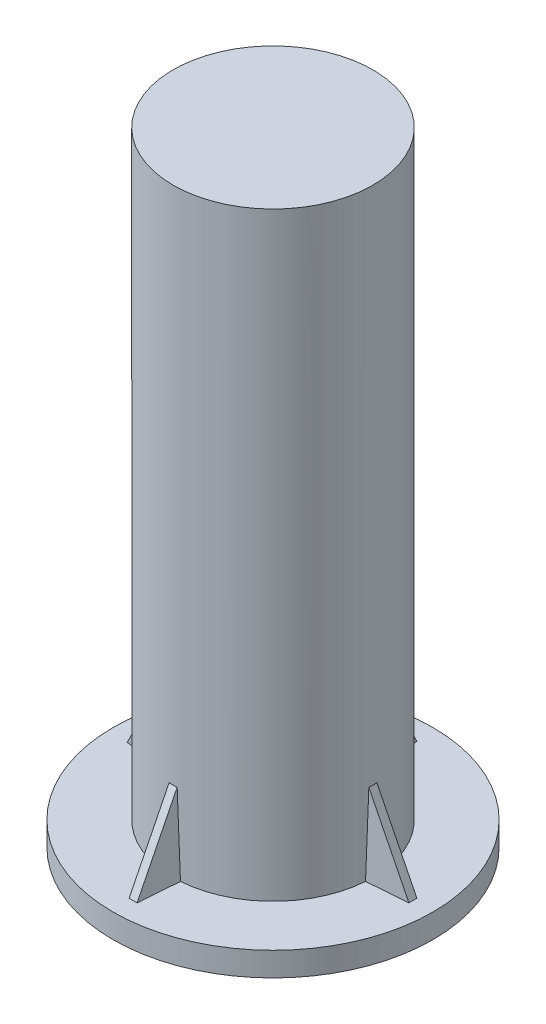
SolidWorks part; units mm, degrees
ref_plane "Alzado" through (0, 0, 0) normal (0, 0, 1) x (1, 0, 0)
ref_plane "Planta" through (0, 0, 0) normal (0, 1, 0) x (1, 0, 0)
ref_plane "Vista lateral" through (0, 0, 0) normal (1, 0, 0) x (0, 0, -1)
sketch "Croquis1" plane through (0, 0, 0) normal (0, 1, 0) x (1, 0, 0)
  circle A0 centre (0, 0) radius 40
  circle A1 centre (0, 0) radius 5
  dimension "D1" = 80
extrude "Saliente-Extruir2" add sketch "Croquis1" along normal blind 6
sketch "Croquis3" plane through (0, 6, 0) normal (0, 1, 0) x (1, 0, 0)
  circle A0 centre (0, 0) radius 25
  dimension "D1" = 50
extrude "Saliente-Extruir3" add sketch "Croquis3" along normal blind 150
ref_plane "Plano1" through (0, 0, 0) normal (0, 0, 1) x (1, 0, 0)
sketch "Croquis9" plane through (0, 0, 0) normal (0, 0, 1) x (1, 0, 0)
  line L0 (-35, 6) -> (-25, 26)
  line L1 (40, 6) -> (-40, 6) construction
  line L2 (-25, 156) -> (-25, 6) construction
  dimension "D3" = 20
  dimension "D4" = 10
rib "Nervio26" sketch "Croquis9" sketch "Croquis9" thickness 3 extrusion direction parallel to sketch draft on yes draft angle 5 parameters "D1"=3, "D3"=5
sketch "Croquis11" plane through (0, 0, 0) normal (0, 0, 1) x (1, 0, 0)
  line L0 (35, 6) -> (25, 26)
  line L1 (40, 6) -> (-40, 6) construction
  line L2 (25, 6) -> (25, 156) construction
  dimension "D1" = 20
  dimension "D2" = 10
rib "Nervio27" sketch "Croquis11" sketch "Croquis11" thickness 2 extrusion direction parallel to sketch draft on yes draft angle 5 parameters "D1"=2, "D3"=5
ref_plane "Plano2" through (0, 0, 0) normal (1, 0, 0) x (0, 0, -1)
sketch "Croquis12" plane through (0, 0, 0) normal (1, 0, 0) x (0, 0, -1)
  line L0 (-35, 6) -> (-25, 26)
  line L1 (40, 6) -> (-40, 6) construction
  line L2 (-25, 156) -> (-25, 6) construction
  dimension "D1" = 20
  dimension "D2" = 10
rib "Nervio28" sketch "Croquis12" sketch "Croquis12" thickness 2 extrusion direction parallel to sketch draft on yes draft angle 5 parameters "D1"=2, "D3"=5
sketch "Croquis13" plane through (0, 0, 0) normal (1, 0, 0) x (0, 0, -1)
  line L0 (35, 6) -> (25, 26)
  line L1 (40, 6) -> (-40, 6) construction
  line L2 (25, 6) -> (25, 156) construction
  dimension "D1" = 20
  dimension "D2" = 10
rib "Nervio29" sketch "Croquis13" sketch "Croquis13" thickness 2 extrusion direction parallel to sketch draft on yes draft angle 5 parameters "D1"=2, "D3"=5
